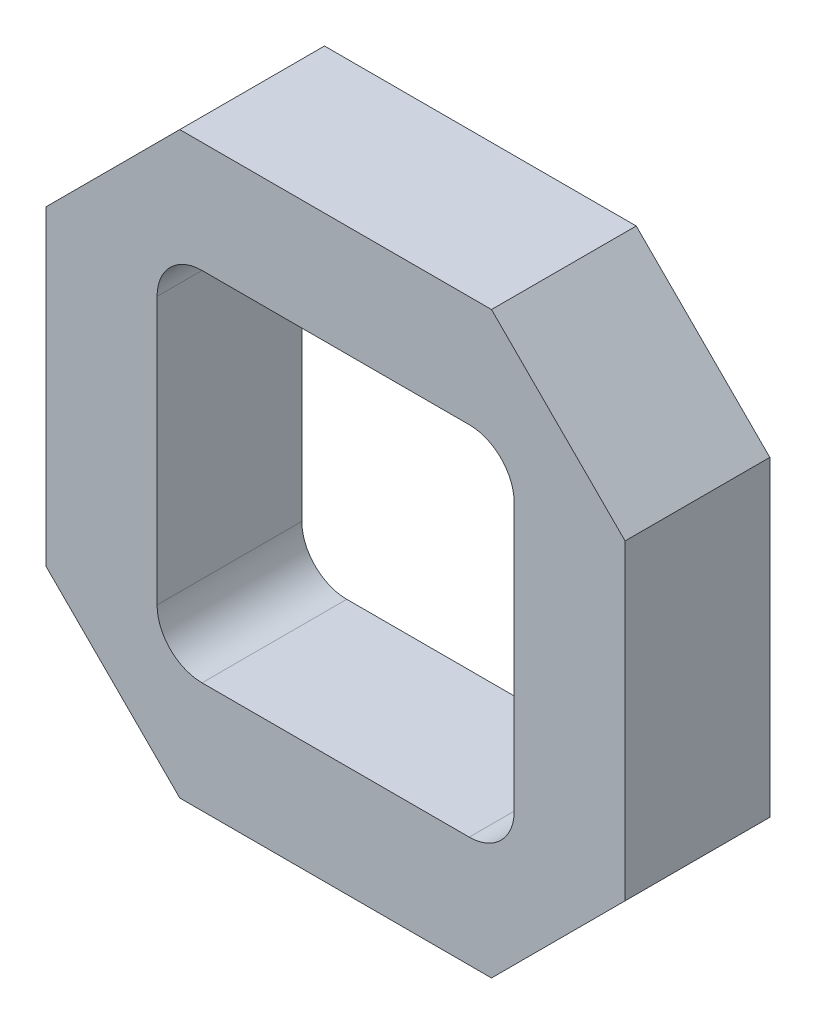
SolidWorks part; units mm, degrees
ref_plane "Front Plane" through (0, 0, 0) normal (1, 0, 0) x (0, 1, 0)
ref_plane "Top Plane" through (0, 0, 0) normal (0, 0, 1) x (0, 1, 0)
ref_plane "Right Plane" through (0, 0, 0) normal (0, 1, 0) x (-1, 0, 0)
sketch "8in beam" plane through (0, 0, 0) normal (0, 0, 1) x (0, 1, 0)
  line B0 (-76.2, -88.9) -> (76.2, -88.9)
  line B1 (-88.9, -76.2) -> (-88.9, 76.2)
  line B2 (76.2, 88.9) -> (-76.2, 88.9)
  line B3 (88.9, 76.2) -> (88.9, -76.2)
  line B4 (-76.2, -101.6) -> (76.2, -101.6)
  line B5 (-101.6, -76.2) -> (-101.6, 76.2)
  line B6 (76.2, 101.6) -> (-76.2, 101.6)
  line B7 (101.6, 76.2) -> (101.6, -76.2)
  arc B8 (101.6, 76.2) -> (76.2, 101.6) centre (76.2, 76.2) ccw
  arc B9 (76.2, -101.6) -> (101.6, -76.2) centre (76.2, -76.2) ccw
  arc B10 (-101.6, -76.2) -> (-76.2, -101.6) centre (-76.2, -76.2) ccw
  arc B11 (-76.2, 101.6) -> (-101.6, 76.2) centre (-76.2, 76.2) ccw
  arc B12 (-76.2, 88.9) -> (-88.9, 76.2) centre (-76.2, 76.2) ccw
  arc B13 (88.9, 76.2) -> (76.2, 88.9) centre (76.2, 76.2) ccw
  arc B14 (76.2, -88.9) -> (88.9, -76.2) centre (76.2, -76.2) ccw
  arc B15 (-88.9, -76.2) -> (-76.2, -88.9) centre (-76.2, -76.2) ccw
  line B16 (-76.2, 76.2) -> (76.2, -76.2) construction
sketch_block_instance "8x8x0.5-1"
sketch_block "8x8x0.5" parameters "D1"=25.4, "D2"=12.7, "D3"=12.7, "D4"=12.7, "D5"=203.2, "D6"=203.2, "D7"=177.8, "D8"=177.8
sketch "Sketch2" plane through (0, 0, 0) normal (0, 0, 1) x (0, 1, 0)
  line L4 (-76.2, 76.2) -> (76.2, -76.2) construction
  line L5 (-165.1, 165.1) -> (165.1, 165.1)
  line L6 (-165.1, 165.1) -> (-165.1, -165.1)
  line L7 (-165.1, -165.1) -> (165.1, -165.1)
  line L8 (-101.854, 76.2) -> (-101.854, -76.2)
  line L9 (-76.2, -101.854) -> (76.2, -101.854)
  line L10 (101.854, -76.2) -> (101.854, 76.2)
  line L11 (76.2, 101.854) -> (-76.2, 101.854)
  line L12 (-101.854, 76.2) -> (-101.854, -76.2)
  line L13 (-76.2, -101.854) -> (76.2, -101.854)
  line L14 (101.854, -76.2) -> (101.854, 76.2)
  line L15 (76.2, 101.854) -> (-76.2, 101.854)
  line L16 (165.1, 165.1) -> (165.1, -165.1)
  line L17 (-165.1, 165.1) -> (165.1, -165.1) construction
  line L18 (-165.1, -165.1) -> (165.1, 165.1) construction
  arc A8 (-76.2, 101.854) -> (-101.854, 76.2) centre (-76.2, 76.2) ccw
  arc A9 (-101.854, -76.2) -> (-76.2, -101.854) centre (-76.2, -76.2) ccw
  arc A10 (76.2, -101.854) -> (101.854, -76.2) centre (76.2, -76.2) ccw
  arc A11 (101.854, 76.2) -> (76.2, 101.854) centre (76.2, 76.2) ccw
  arc A12 (-76.2, 101.854) -> (-101.854, 76.2) centre (-76.2, 76.2) ccw
  arc A13 (-101.854, -76.2) -> (-76.2, -101.854) centre (-76.2, -76.2) ccw
  arc A14 (76.2, -101.854) -> (101.854, -76.2) centre (76.2, -76.2) ccw
  arc A15 (101.854, 76.2) -> (76.2, 101.854) centre (76.2, 76.2) ccw
  point P0 (0, 0)
  dimension "D2" = 330.2
  dimension "D1" = 0.254
extrude "Boss-Extrude1" add sketch "Sketch2" along normal blind 101.6
chamfer "Chamfer1" distance 76.2 angle 45 4 edges at (-165.1, -165.1, 50.8) (-165.1, 165.1, 50.8) (165.1, -165.1, 50.8) (165.1, 165.1, 50.8)
sketch "Sketch3" [suppressed] plane through (0, 0, 0) normal (1, 0, 0) x (0, 1, 0)
  line L0 (101.6, 101.6) -> (101.6, 76.2)
  line L1 (101.6, 76.2) -> (122.7667, 76.2)
  line L2 (122.7667, 76.2) -> (122.7667, 50.8)
  line L3 (122.7667, 50.8) -> (143.9333, 50.8)
  line L4 (143.9333, 50.8) -> (143.9333, 25.4)
  line L5 (143.9333, 25.4) -> (187.8328, 25.4)
  line L7 (187.8328, 101.6) -> (101.6, 101.6)
  line L9 (187.8328, 101.6) -> (187.8328, 25.4)
  line L10 (-165.1, 101.6) -> (165.1, 101.6) construction
  line L12 (0, 0) -> (0, -68.9155) construction
  line L13 (-187.8328, 101.6) -> (-187.8328, 25.4)
  line L14 (-187.8328, 101.6) -> (-101.6, 101.6)
  line L15 (-143.9333, 25.4) -> (-187.8328, 25.4)
  line L16 (-143.9333, 50.8) -> (-143.9333, 25.4)
  line L17 (-122.7667, 50.8) -> (-143.9333, 50.8)
  line L18 (-122.7667, 76.2) -> (-122.7667, 50.8)
  line L19 (-101.6, 76.2) -> (-122.7667, 76.2)
  line L20 (-101.6, 101.6) -> (-101.6, 76.2)
  dimension "D1" = 25.4
  dimension "D2" = 25.4
  dimension "D3" = 25.4
  dimension "D4" = 21.1667
  dimension "D5" = 21.1667
  dimension "D6" = 101.6
extrude "Cut-Extrude1" [suppressed] cut sketch "Sketch3" against normal through all both and the other way through all
sketch "Sketch4" plane through (0, 0, 0) normal (0, 1, 0) x (-1, 0, 0)
  line B0 (101.6, 101.6) -> (101.6, 76.2)
  line B1 (101.6, 76.2) -> (122.7667, 76.2)
  line B2 (122.7667, 76.2) -> (122.7667, 50.8)
  line B3 (122.7667, 50.8) -> (143.9333, 50.8)
  line B4 (143.9333, 50.8) -> (143.9333, 25.4)
  line B5 (143.9333, 25.4) -> (187.8328, 25.4)
  line B6 (187.8328, 101.6) -> (101.6, 101.6)
  line B7 (187.8328, 101.6) -> (187.8328, 25.4)
  line B8 (0, 0) -> (0, -68.9155) construction
  line B9 (-101.6, 101.6) -> (-101.6, 76.2)
  line B10 (-101.6, 76.2) -> (-122.7667, 76.2)
  line B11 (-122.7667, 76.2) -> (-122.7667, 50.8)
  line B12 (-122.7667, 50.8) -> (-143.9333, 50.8)
  line B13 (-143.9333, 50.8) -> (-143.9333, 25.4)
  line B14 (-143.9333, 25.4) -> (-187.8328, 25.4)
  line B15 (-187.8328, 101.6) -> (-101.6, 101.6)
  line B16 (-187.8328, 101.6) -> (-187.8328, 25.4)
sketch_block_instance "Block1-1"
sketch_block "Block1" parameters "D1"=25.4, "D2"=25.4, "D3"=21.1667, "D4"=21.1667, "D5"=25.4
sketch_block_instance "Block1-2"
extrude "Cut-Extrude2" [suppressed] cut sketch "Sketch4" against normal through all both and the other way through all
sketch "Sketch5" [suppressed] plane through (0, 0, 0) normal (0, 1, 0) x (-1, 0, 0)
  line L0 (122.7667, 76.2) -> (-122.7667, 76.2) construction
  line L1 (-231.5421, 170.4156) -> (183.0067, 170.4156)
  line L2 (-231.5421, 170.4156) -> (-231.5421, 76.2)
  line L3 (-231.5421, 76.2) -> (183.0067, 76.2)
  line L4 (183.0067, 170.4156) -> (183.0067, 76.2)
extrude "Cut-Extrude3" [suppressed] cut sketch "Sketch5" against normal through all both and the other way through all
sketch "Sketch7" plane through (122.7667, 0, 0) normal (1, 0, 0) x (0, 1, 0)
  line L1 (-84.8134, 76.2) -> (-62.4847, 76.2) construction
  line L2 (-122.7667, 76.2) -> (122.7667, 76.2) construction
  line L3 (-82.551, 67.4491) -> (-69.849, 67.4471) construction
  point P0 (0, 52.4572)
  point P7 (-76.2, 67.4481)
  dimension "D1" = 76.2
  dimension "D2" = 76.2
sketch_block_instance "Cross Stair-1"
sketch_block "Cross Stair" parameters "D6"=3.174, "D1"=6.35, "D2"=6.35, "D3"=4.2342, "D4"=6.35, "D5"=6.35
sketch_block_instance "Cross Stair-2"
sketch_block_instance "Cross Stair-3"
extrude "Cut-Extrude4" [suppressed] cut sketch "Sketch7" against normal blind 6
sketch "Sketch8" plane through (143.9333, 0, 0) normal (1, 0, 0) x (0, 1, 0)
  line L0 (-3.175, 64.2731) -> (-3.175, 55.6312) construction
  line L1 (-73.025, 55.6312) -> (-73.025, 64.2731) construction
  line L2 (73.025, 64.2731) -> (73.025, 55.6312) construction
  line L3 (-143.9333, 50.8) -> (143.9333, 50.8) construction
  dimension "D1" = 25.4
  dimension "D2" = 25.4
  dimension "D3" = 1.5
sketch_block_instance "Cross Stair-4"
sketch_block_instance "Cross Stair-8"
sketch_block_instance "Cross Stair-9"
extrude "Cut-Extrude5" [suppressed] cut sketch "Sketch8" against normal blind 6
sketch "Sketch11" plane through (165.1, 0, 0) normal (1, 0, 0) x (0, 1, 0)
  line L0 (-3.175, 38.7158) -> (-3.175, 30.074) construction
  line L1 (-143.9333, 25.4) -> (143.9333, 25.4) construction
  line L2 (-98.425, 30.074) -> (-98.425, 38.7158) construction
  line L3 (104.775, 30.074) -> (104.775, 38.7158) construction
  dimension "D1" = 1.5
  dimension "D2" = 25.4
  dimension "D3" = 25.4
sketch_block_instance "Cross Stair-11"
sketch_block_instance "Cross Stair-12"
sketch_block_instance "Cross Stair-13"
extrude "Cut-Extrude6" [suppressed] cut sketch "Sketch11" against normal blind 6
sketch "Sketch12" plane through (0, -122.7667, 0) normal (0, -1, 0) x (1, 0, 0)
  line L0 (-6.351, 67.2898) -> (6.351, 67.2898) construction
  line L2 (-122.7667, 76.2) -> (122.7667, 76.2) construction
  point P2 (0, 67.2898)
  dimension "D1" = 1.5
  dimension "D2" = 76.2
  dimension "D3" = 76.2
sketch_block_instance "Cross Stair-14"
sketch_block_instance "Cross Stair-15"
sketch_block_instance "Cross Stair-16"
sketch "Sketch13" plane through (0, -143.9333, 0) normal (0, -1, 0) x (1, 0, 0)
  line L0 (3.175, 55.474) -> (3.175, 64.1158) construction
  line L1 (-122.7667, 50.8) -> (122.7667, 50.8) construction
  line L2 (73.025, 64.1158) -> (73.025, 55.474) construction
  line L3 (-73.025, 55.474) -> (-73.025, 64.1158) construction
  dimension "D1" = 1.5
  dimension "D2" = 25.4
  dimension "D3" = 25.4
sketch_block_instance "Cross Stair-17"
sketch_block_instance "Cross Stair-18"
sketch_block_instance "Cross Stair-19"
sketch "Sketch14" plane through (0, -165.1, 0) normal (0, -1, 0) x (1, 0, 0)
  line L0 (3.175, 30.074) -> (3.175, 38.7158) construction
  line L1 (-98.425, 30.074) -> (-98.425, 38.7158) construction
  line L2 (98.425, 38.7158) -> (98.425, 30.074) construction
  line L3 (165.1, 25.4) -> (-165.1, 25.4) construction
  dimension "D1" = 25.4
  dimension "D2" = 25.4
  dimension "D3" = 1.5
sketch_block_instance "Cross Stair-20"
sketch_block_instance "Cross Stair-21"
sketch_block_instance "Cross Stair-22"
extrude "Cut-Extrude7" [suppressed] cut sketch "Sketch12" against normal blind 6
extrude "Cut-Extrude8" [suppressed] cut sketch "Sketch13" against normal blind 6
extrude "Cut-Extrude9" [suppressed] cut sketch "Sketch14" against normal blind 6
sketch "Sketch15" plane through (-122.7667, 0, 0) normal (-1, 0, 0) x (0, -1, 0)
  line L0 (-6.351, 67.2918) -> (6.351, 67.2898) construction
  line L1 (122.7667, 76.2) -> (-122.7667, 76.2) construction
  point P2 (0, 67.2908)
  dimension "D1" = 1.5
  dimension "D2" = 76.2
  dimension "D3" = 76.2
sketch_block_instance "Cross Stair-23"
sketch_block_instance "Cross Stair-24"
sketch_block_instance "Cross Stair-25"
sketch "Sketch16" plane through (-143.9333, 0, 0) normal (-1, 0, 0) x (0, -1, 0)
  line L0 (-6.351, 41.8918) -> (6.351, 41.8898) construction
  line L1 (143.9333, 50.8) -> (-143.9333, 50.8) construction
  line L2 (73.025, 64.1158) -> (73.025, 55.474) construction
  line L3 (-73.025, 55.474) -> (-73.025, 64.1158) construction
  point P2 (0, 41.8908)
  point P7 (98.425, 34.3949)
  dimension "D1" = 1.5
  dimension "D2" = 25.4
  dimension "D3" = 25.4
sketch_block_instance "Cross Stair-26"
sketch_block_instance "Cross Stair-27"
sketch_block_instance "Cross Stair-28"
sketch "Sketch17" plane through (-165.1, 0, 0) normal (-1, 0, 0) x (0, -1, 0)
  line L0 (-6.351, 16.4918) -> (6.351, 16.4898) construction
  line L1 (3.175, 30.074) -> (3.175, 38.7158) construction
  line L2 (143.9333, 25.4) -> (-143.9333, 25.4) construction
  line L3 (98.425, 38.7158) -> (98.425, 30.074) construction
  line L4 (-98.425, 30.074) -> (-98.425, 38.7158) construction
  point P2 (0, 16.4908)
  dimension "D1" = 1.5
  dimension "D2" = 25.4
  dimension "D3" = 25.4
sketch_block_instance "Cross Stair-29"
sketch_block_instance "Cross Stair-30"
sketch_block_instance "Cross Stair-31"
extrude "Cut-Extrude10" [suppressed] cut sketch "Sketch15" against normal blind 6
extrude "Cut-Extrude11" [suppressed] cut sketch "Sketch16" against normal blind 6
extrude "Cut-Extrude12" [suppressed] cut sketch "Sketch17" against normal blind 6
sketch "Sketch18" plane through (0, 122.7667, 0) normal (0, 1, 0) x (-1, 0, 0)
  line L0 (-6.351, 67.2918) -> (6.351, 67.2898) construction
  line L1 (122.7667, 76.2) -> (-122.7667, 76.2) construction
  point P2 (0, 67.2908)
  dimension "D1" = 76.2
  dimension "D2" = 76.2
  dimension "D3" = 1.5
sketch_block_instance "Cross Stair-32"
sketch_block_instance "Cross Stair-33"
sketch_block_instance "Cross Stair-34"
sketch "Sketch19" plane through (0, 143.9333, 0) normal (0, 1, 0) x (-1, 0, 0)
  line L0 (-6.351, 41.8918) -> (6.351, 41.8898) construction
  line L1 (3.175, 55.474) -> (3.175, 64.1158) construction
  line L2 (73.025, 64.1158) -> (73.025, 55.474) construction
  line L3 (122.7667, 50.8) -> (-122.7667, 50.8) construction
  line L4 (-73.025, 55.474) -> (-73.025, 64.1158) construction
  point P2 (0, 41.8908)
  dimension "D1" = 25.4
  dimension "D2" = 1.5
  dimension "D3" = 25.4
sketch_block_instance "Cross Stair-35"
sketch_block_instance "Cross Stair-36"
sketch_block_instance "Cross Stair-37"
sketch "Sketch20" plane through (0, 165.1, 0) normal (0, 1, 0) x (-1, 0, 0)
  line L0 (-6.351, 16.4918) -> (6.351, 16.4898) construction
  line L1 (3.175, 30.074) -> (3.175, 38.7158) construction
  line L2 (143.9333, 25.4) -> (-143.9333, 25.4) construction
  line L3 (98.425, 38.7158) -> (98.425, 30.074) construction
  line L4 (-98.425, 30.074) -> (-98.425, 38.7158) construction
  point P2 (0, 16.4908)
  dimension "D1" = 1.5
  dimension "D2" = 25.4
  dimension "D3" = 25.4
sketch_block_instance "Cross Stair-38"
sketch_block_instance "Cross Stair-39"
sketch_block_instance "Cross Stair-40"
extrude "Cut-Extrude13" [suppressed] cut sketch "Sketch18" against normal blind 6
extrude "Cut-Extrude14" [suppressed] cut sketch "Sketch19" against normal blind 6
extrude "Cut-Extrude15" [suppressed] cut sketch "Sketch20" against normal blind 6
sketch "Sketch21" plane through (0, 0, 0) normal (0, 0, -1) x (1, 0, 0)
  line L1 (-248.2496, 204.5765) -> (272.8317, 204.5765)
  line L2 (-248.2496, 204.5765) -> (-248.2496, -215.6741)
  line L3 (-248.2496, -215.6741) -> (272.8317, -215.6741)
  line L4 (272.8317, 204.5765) -> (272.8317, -215.6741)
extrude "Cut-Extrude16" cut sketch "Sketch21" against normal blind 19.05
